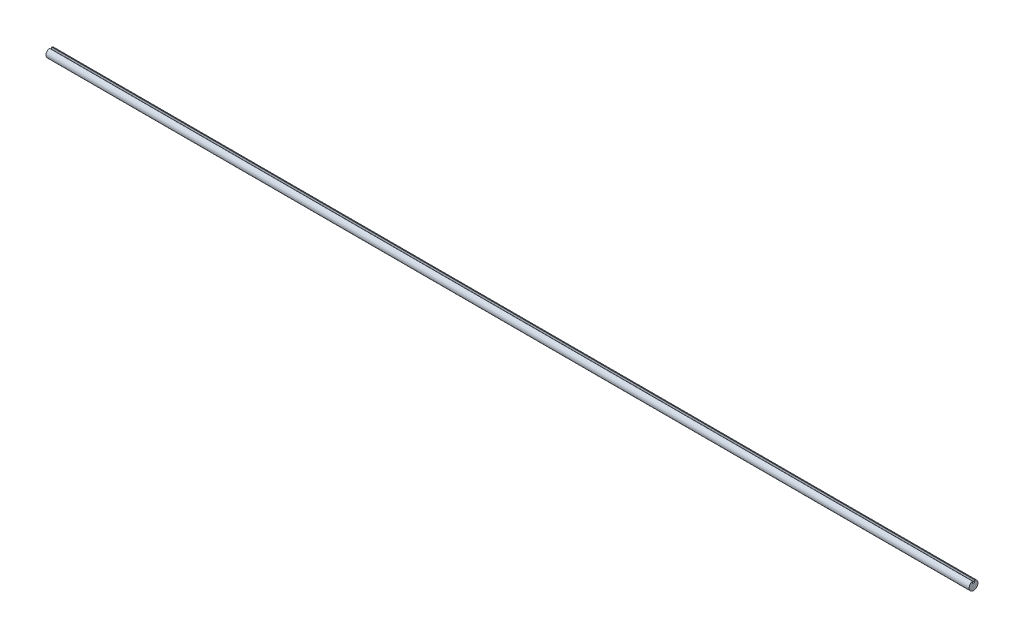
SolidWorks part; units mm, degrees
ref_plane "Front Plane" through (0, 0, 0) normal (0, 0, 1) x (1, 0, 0)
ref_plane "Top Plane" through (0, 0, 0) normal (0, 1, 0) x (1, 0, 0)
ref_plane "Right Plane" through (0, 0, 0) normal (1, 0, 0) x (0, 0, -1)
sketch "Sketch1" plane through (0, 0, 0) normal (1, 0, 0) x (0, 0, -1)
  line L0 (0, 6.35) -> (0, 3.175) construction
  line L1 (-1.5875, 6.1484) -> (-1.5875, 3.175)
  line L2 (1.5875, 6.1484) -> (1.5875, 3.175)
  line L3 (-1.5875, 3.175) -> (1.5875, 3.175)
  line L4 (-1.5875, 6.35) -> (-1.5875, 3.175) construction
  line L5 (1.5875, 6.35) -> (1.5875, 3.175) construction
  arc A0 (-1.5875, 6.1484) -> (1.5875, 6.1484) centre (0, 0) ccw
  dimension "D1" = 12.7
  dimension "D4" = 3.175
  dimension "D2" = 1.5875
  dimension "D3" = 1.5875
extrude "Boss-Extrude1" add sketch "Sketch1" along normal mid plane 1320.8
